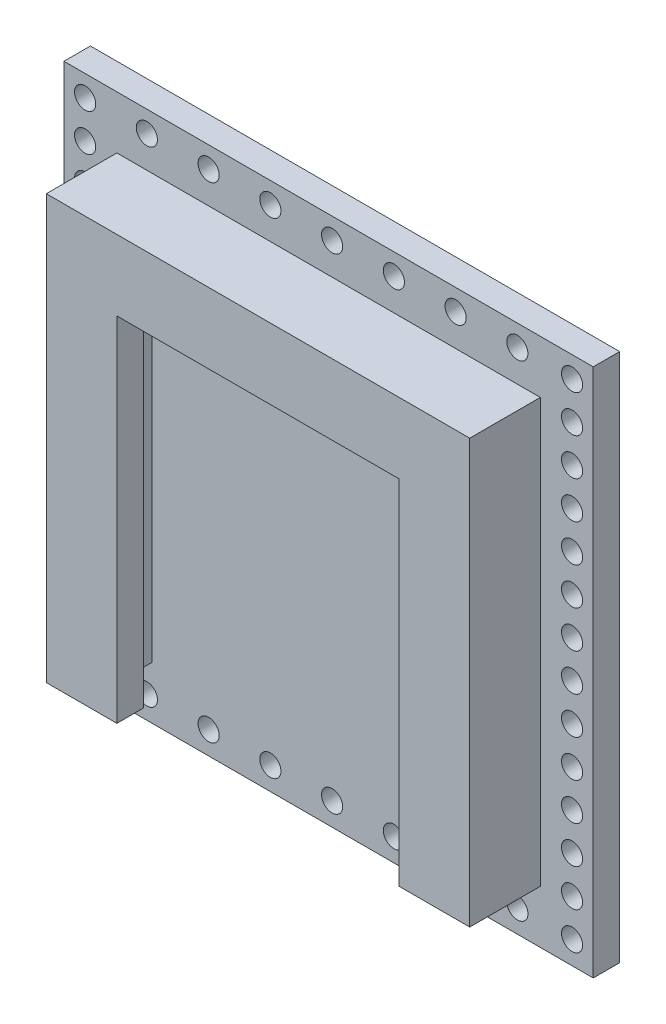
SolidWorks part; units mm, degrees
ref_plane "Alzado" through (0, 0, 0) normal (0, 0, 1) x (1, 0, 0)
ref_plane "Planta" through (0, 0, 0) normal (0, 1, 0) x (1, 0, 0)
ref_plane "Vista lateral" through (0, 0, 0) normal (1, 0, 0) x (0, 0, -1)
sketch "Sketch1" plane through (0, 0, 0) normal (0, 0, 1) x (1, 0, 0)
  line L1 (-15, -15) -> (15, -15)
  line L2 (-15, -15) -> (-15, 15)
  line L3 (-15, 15) -> (15, 15)
  line L4 (15, -15) -> (15, 15)
  line L5 (-15, -15) -> (15, 15) construction
  line L6 (-15, 15) -> (15, -15) construction
  point P0 (0, 0)
  dimension "D1" = 30
  dimension "D2" = 30
extrude "Boss-Extrude1" add sketch "Sketch1" along normal blind 1 and the other way blind 0.5
sketch "Sketch2" plane through (0, 0, 1) normal (0, 0, 1) x (1, 0, 0)
  line L0 (-15, 15) -> (-15, -15) construction
  line L1 (15, 15) -> (-15, 15) construction
  line L2 (-15, -15) -> (15, -15) construction
  line L3 (15, -15) -> (15, 15) construction
  circle A0 centre (-13.8, 13.8) radius 0.6
  circle A1 centre (-13.8, 11.6846) radius 0.6
  circle A2 centre (-13.8, 9.5692) radius 0.6
  circle A3 centre (-13.8, 7.4538) radius 0.6
  circle A4 centre (-13.8, 5.3385) radius 0.6
  circle A5 centre (-13.8, 3.2231) radius 0.6
  circle A6 centre (-13.8, 1.1077) radius 0.6
  circle A7 centre (-13.8, -1.0077) radius 0.6
  circle A8 centre (-13.8, -3.1231) radius 0.6
  circle A9 centre (-13.8, -5.2385) radius 0.6
  circle A10 centre (-13.8, -7.3538) radius 0.6
  circle A11 centre (-13.8, -9.4692) radius 0.6
  circle A12 centre (-13.8, -11.5846) radius 0.6
  circle A13 centre (-13.8, -13.7) radius 0.6
  circle A14 centre (13.8, 13.8) radius 0.6
  circle A15 centre (13.8, 11.6846) radius 0.6
  circle A16 centre (13.8, 9.5692) radius 0.6
  circle A17 centre (13.8, 7.4538) radius 0.6
  circle A18 centre (13.8, 5.3385) radius 0.6
  circle A19 centre (13.8, 3.2231) radius 0.6
  circle A20 centre (13.8, 1.1077) radius 0.6
  circle A21 centre (13.8, -1.0077) radius 0.6
  circle A22 centre (13.8, -3.1231) radius 0.6
  circle A23 centre (13.8, -5.2385) radius 0.6
  circle A24 centre (13.8, -7.3538) radius 0.6
  circle A25 centre (13.8, -9.4692) radius 0.6
  circle A26 centre (13.8, -11.5846) radius 0.6
  circle A27 centre (13.8, -13.7) radius 0.6
  circle A28 centre (-10.3, 13.8) radius 0.6
  circle A29 centre (-6.8, 13.8) radius 0.6
  circle A30 centre (-3.3, 13.8) radius 0.6
  circle A31 centre (0.2, 13.8) radius 0.6
  circle A32 centre (3.7, 13.8) radius 0.6
  circle A33 centre (7.2, 13.8) radius 0.6
  circle A34 centre (10.7, 13.8) radius 0.6
  circle A35 centre (-10.3, -13.7) radius 0.6
  circle A36 centre (-6.8, -13.7) radius 0.6
  circle A37 centre (-3.3, -13.7) radius 0.6
  circle A38 centre (0.2, -13.7) radius 0.6
  circle A39 centre (3.7, -13.7) radius 0.6
  circle A40 centre (7.2, -13.7) radius 0.6
  circle A41 centre (10.7, -13.7) radius 0.6
extrude "Cut-Extrude1" cut sketch "Sketch2" against normal blind 9
sketch "Sketch3" plane through (0, 0, 1) normal (0, 0, 1) x (1, 0, 0)
  line L0 (-8, -12) -> (-8, 8)
  line L1 (-12, -12) -> (-8, -12)
  line L2 (-12, -12) -> (-12, 12)
  line L3 (-12, 12) -> (12, 12)
  line L4 (12, -12) -> (12, 12)
  line L5 (-12, -12) -> (12, 12) construction
  line L6 (-12, 12) -> (12, -12) construction
  line L7 (-8, 8) -> (8, 8)
  line L8 (8, 8) -> (8, -12)
  line L9 (8, -12) -> (12, -12)
  point P0 (0, 0)
extrude "Boss-Extrude2" add sketch "Sketch3" along normal blind 4
sketch "Sketch4" plane through (0, -12, 0) normal (0, -1, 0) x (1, 0, 0)
  line L0 (8, 1) -> (12, 1) construction
  line L1 (-10, 3.5) -> (10, 3.5)
  line L2 (-10, 3.5) -> (-10, 1)
  line L3 (-10, 1) -> (10, 1)
  line L4 (10, 3.5) -> (10, 1)
  line L5 (-10, 3.5) -> (10, 1) construction
  line L6 (-10, 1) -> (10, 3.5) construction
  point P0 (0, 2.25)
  dimension "D1" = 20
  dimension "D2" = 2.5
extrude "Cut-Extrude2" cut sketch "Sketch4" against normal up to surface (20 mm away)
equation "\"hoyo\"=1.2"
equation "\"D1@Sketch2\"=\"hoyo\""
equation "\"D2@Sketch2\"=\"hoyo\""
equation "\"D3@Sketch2\"=\"hoyo\""
equation "\"space\"= 4"
equation "\"D3@Sketch3\"=\"space\""
equation "\"D4@Sketch3\"=\"space\""
equation "\"D5@Sketch3\"=\"space\""
equation "\"iman\"= 10.2"
